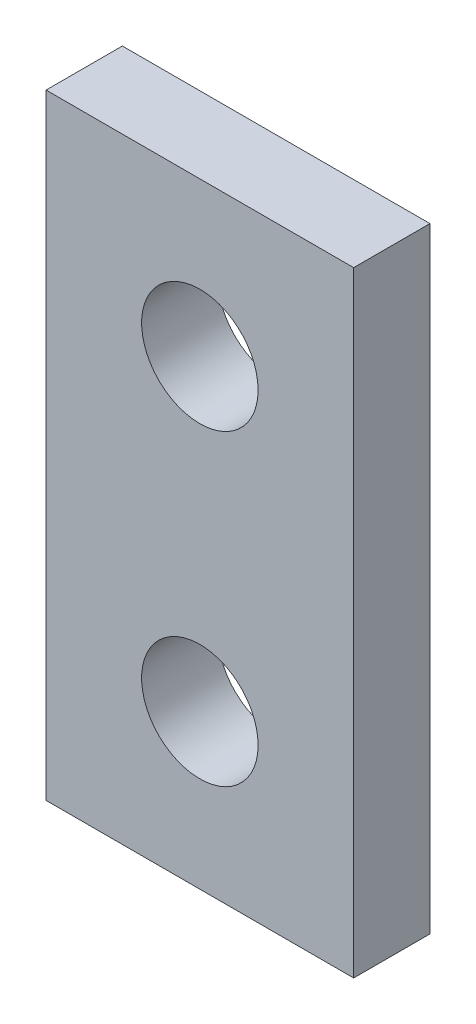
SolidWorks part; units mm, degrees
ref_plane "Front Plane" through (0, 0, 0) normal (0, 0, 1) x (1, 0, 0)
ref_plane "Top Plane" through (0, 0, 0) normal (0, 1, 0) x (1, 0, 0)
ref_plane "Right Plane" through (0, 0, 0) normal (1, 0, 0) x (0, 0, -1)
sketch "Sketch1" plane through (0, 0, 0) normal (0, 0, 1) x (1, 0, 0)
  line L1 (-4.7625, -9.525) -> (4.7625, -9.525)
  line L2 (-4.7625, -9.525) -> (-4.7625, 9.525)
  line L3 (-4.7625, 9.525) -> (4.7625, 9.525)
  line L4 (4.7625, -9.525) -> (4.7625, 9.525)
  line L5 (-4.7625, -9.525) -> (4.7625, 9.525) construction
  line L6 (-4.7625, 9.525) -> (4.7625, -9.525) construction
  point P0 (0, 0)
  dimension "D1" = 19.05
  dimension "D2" = 9.525
extrude "Boss-Extrude1" add sketch "Sketch1" against normal blind 2.3622
sketch "Sketch2" plane through (0, 0, 0) normal (0, 0, 1) x (1, 0, 0)
  line L1 (-1.2973, -4.7625) -> (1.2973, -4.7625) construction
  line L2 (-1.2973, -4.7625) -> (-1.2973, 4.7625) construction
  line L3 (-1.2973, 4.7625) -> (1.2973, 4.7625) construction
  line L4 (1.2973, -4.7625) -> (1.2973, 4.7625) construction
  line L5 (-1.2973, -4.7625) -> (1.2973, 4.7625) construction
  line L6 (-1.2973, 4.7625) -> (1.2973, -4.7625) construction
  circle A0 centre (0, 4.7625) radius 1.8034
  circle A1 centre (0, -4.7625) radius 1.8034
  point P0 (0, 0)
  dimension "D3" = 3.6068
  dimension "D1" = 9.525
  dimension "D2" = 2.5947
extrude "Cut-Extrude1" cut sketch "Sketch2" against normal through all
